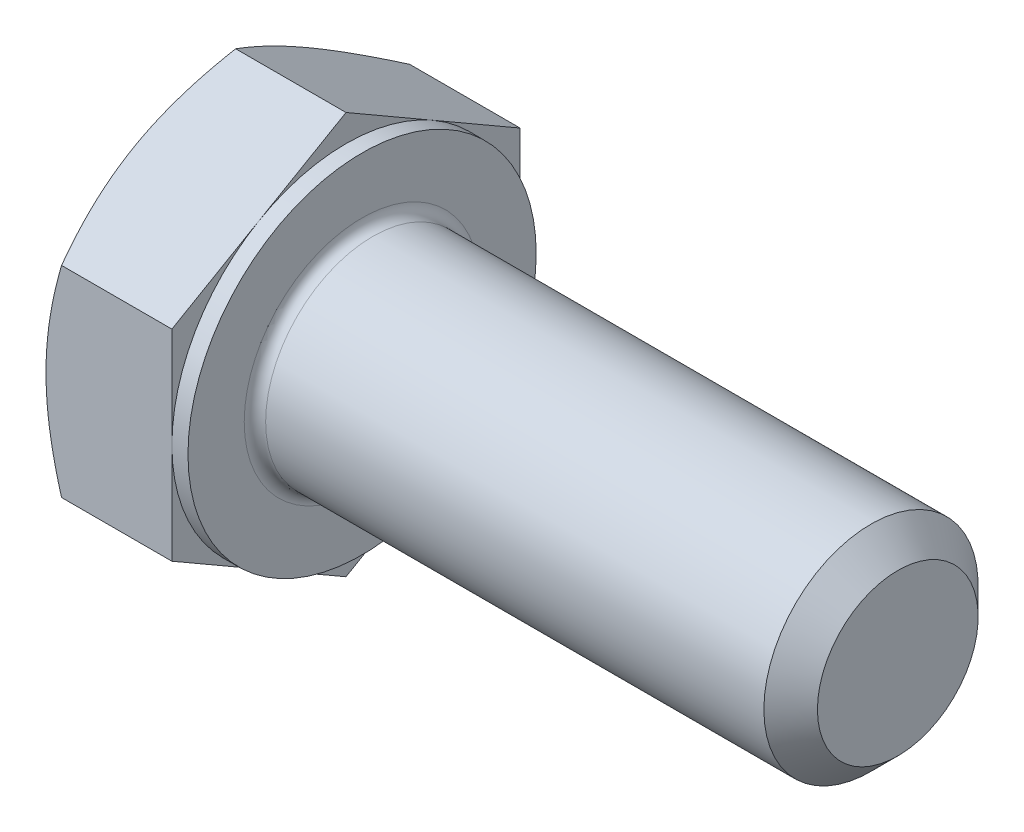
SolidWorks part; units mm, degrees
extrude "基体-拉伸" add sketch "草图1" along normal blind 5.3
sketch "草图1" plane through (0, 0, 0) normal (1, 0, 0) x (0, 0, -1)
  line L0 (6.5, 3.7528) -> (6.5, -3.7528)
  line L1 (-6.5, 3.7528) -> (-6.5, -3.7528)
  line L2 (6.5, -3.7528) -> (0, -7.5056)
  line L3 (0, -7.5056) -> (-6.5, -3.7528)
  line L4 (6.5, 3.7528) -> (0, 7.5056)
  line L5 (0, 7.5056) -> (-6.5, 3.7528)
revolve "切除-旋转1" cut sketch "草图3" angle 360 about L6
sketch "草图3" plane through (0, 0, 0) normal (0, 0, 1) x (1, 0, 0)
  line L0 (0, 6.5) -> (3.4673, 12.5056)
  line L1 (0, 7.5056) -> (0, 3.7528) construction
  line L2 (3.4673, 12.5056) -> (3.4673, 17.5056)
  line L3 (3.4673, 17.5056) -> (-10, 17.5056)
  line L4 (-10, 17.5056) -> (-10, 6.5)
  line L5 (-10, 6.5) -> (0, 6.5)
  line L6 (0, 0) -> (99.06, 0) construction
  line L7 (5.3, 7.5056) -> (0, 7.5056) construction
revolve "凸台-旋转1" add sketch "草图2" angle 360 about L7
sketch "草图2" plane through (0, 0, 0) normal (0, 0, 1) x (1, 0, 0)
  line L0 (0, 3.7528) -> (0, -3.7528) construction
  line L1 (0, 0) -> (25.3, 0)
  line L2 (0, 0) -> (0, 4)
  line L3 (0, 4) -> (25.3, 4)
  line L4 (25.3, 0) -> (25.3, 2.9175)
  line L5 (5.3, 7.5056) -> (5.3, 3.7528) construction
  line L7 (0, 0) -> (96.52, 0) construction
  line L8 (25.3, -2.9175) -> (90.335, -4) construction
  line L9 (0, -4) -> (90.335, -4) construction
  line L10 (6.55, 15.24) -> (6.55, -1.27) construction
  line L11 (5.3, 15.24) -> (5.3, -1.27) construction
  line L12 (5.3, 3.7528) -> (5.3, -3.7528) construction
  line L14 (25.3, 4) -> (25.3, 2.9175)
  dimension "l" = 20
  dimension "m" = 8
  dimension "Minor_dia" = 5.835
  dimension "p" = 1.25
  dimension "h" = 20
ref_plane "前视" through (0, 0, 0) normal (0, 0, 1) x (1, 0, 0)
ref_plane "上视" through (0, 0, 0) normal (0, 1, 0) x (1, 0, 0)
ref_plane "右视" through (0, 0, 0) normal (1, 0, 0) x (0, 0, -1)
sketch "草图5" plane through (0, 0, 0) normal (0, 0, 1) x (1, 0, 0)
  line L0 (5.3, 6.5) -> (1.8327, 12.5056)
  line L1 (5.3, 7.5056) -> (5.3, 3.7528) construction
  line L2 (1.8327, 12.5056) -> (1.8327, 17.5056)
  line L3 (1.8327, 17.5056) -> (11.8327, 17.5056)
  line L4 (11.8327, 17.5056) -> (11.8327, 6.5)
  line L5 (11.8327, 6.5) -> (5.3, 6.5)
  line L7 (5.3, 7.5056) -> (0.5806, 7.5056) construction
  line L8 (0, 0) -> (99.06, 0) construction
  line L9 (0, 0) -> (99.06, 0) construction
revolve "切除-旋转2" cut sketch "草图5" angle 360 about L8
sketch "草图4" plane through (0, 0, 0) normal (0, 0, 1) x (1, 0, 0)
  line L1 (5.3, 7.5056) -> (5.3, 3.7528) construction
  line L2 (5.3, 6.5) -> (4.7, 6.5)
  line L3 (5.3, 6.5) -> (5.3, 17.5056)
  line L4 (5.3, 17.5056) -> (4.7, 17.5056)
  line L5 (0, 0) -> (95.25, 0) construction
  line L6 (0, 0) -> (96.52, 0) construction
  line L7 (4.7, 6.5) -> (4.7, 17.5056)
  line L8 (4.7194, 7.5056) -> (0.5806, 7.5056) construction
revolve "切除-旋转3" cut sketch "草图4" angle 360 about L5
chamfer "倒角" distance 1 angle 45 1 edges at (25.3, 0, 4)
fillet "圆角" radius 0.4 1 edges at (5.3, 0, -4)
sketch "草图6" plane through (0, 0, 0) normal (0, 0, 1) x (1, 0, 0)
  line L0 (6.325, -2.9175) -> (5.7, -4)
  line L1 (6.325, -2.9175) -> (6.95, -4)
  line L2 (6.95, -4) -> (6.95, -5)
  line L3 (-3.175, 0) -> (5.1513, 0) construction
  line L5 (6.95, -5) -> (5.7, -5)
  line L6 (5.7, -5) -> (5.7, -4)
  arc A0 (5.7, -4) -> (5.3, -4.4) centre (5.7, -4.4) ccw construction
revolve "切除-旋转4" [suppressed] cut sketch "草图6" angle 360 about L3
pattern_linear "阵列(线性)1" [suppressed]
equation "\"D3@草图1\" = \"s@草图1\" / 2"
equation "\"D4@草图1\" = \"D3@草图1\""
equation "\"D5@草图1\" = \"D4@草图1\""
equation "\"D1@草图3\" = \"s@草图1\" / 2"
equation "\"D1@草图5\" = \"s@草图1\" / 2"
equation "\"Head_ch_ang@草图5\" = \"Head_ch_ang@草图3\""
equation "\"D1@草图4\" = \"s@草图1\""
equation "\"Diameter@草图6\" = \"m@草图2\""
equation "\"Overcut@草图6\" = \"m@草图2\" * 1.25"
equation "\"Minor_dia@草图2\" = \"m@草图2\"-\"p@草图2\" * 1.732"
equation "\"Thread_minor@螺旋线1\" = \"Minor_dia@草图2\""
equation "\"Thread_minor@草图6\" = \"Minor_dia@草图2\""
equation "\"D1@倒角\" = \"p@草图2\"*0.8"
equation "\"Thread_length@螺旋线1\" = \"l@草图2\" - \"p@草图2\""
equation "\"Num_threads@阵列(线性)1\" = \"l@草图2\" / \"p@草图2\""
